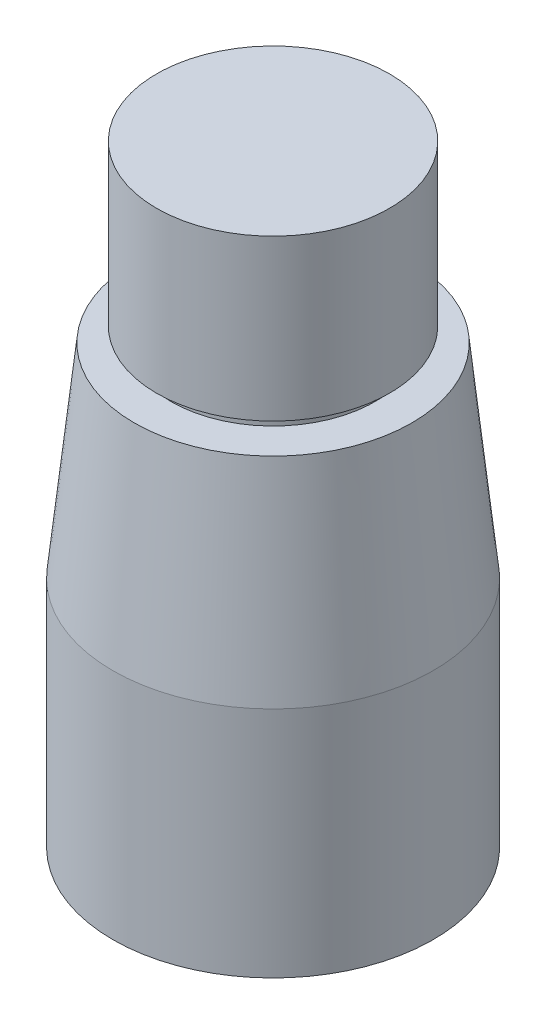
SolidWorks part; units mm, degrees
ref_plane "Front Plane" through (0, 0, 0) normal (0, 0, 1) x (1, 0, 0)
ref_plane "Top Plane" through (0, 0, 0) normal (0, 1, 0) x (1, 0, 0)
ref_plane "Right Plane" through (0, 0, 0) normal (1, 0, 0) x (0, 0, -1)
sketch "Sketch1" plane through (0, 0, 0) normal (0, 0, 1) x (1, 0, 0)
  line L0 (0, 85.1026) -> (0, 0) construction
  line L1 (0, 0) -> (-11, 0)
  line L2 (-11, 0) -> (-11, 16)
  line L3 (-11, 16) -> (-9.5285, 30)
  line L4 (-9.5285, 30) -> (-7, 30)
  line L5 (-7, 30) -> (-7, 31)
  line L6 (-7, 31) -> (-8, 31)
  line L7 (-8, 31) -> (-8, 42)
  line L8 (-8, 42) -> (0, 42)
  line L9 (0, 0) -> (0, 42)
  dimension "D1" = 42
  dimension "D2" = 1
  dimension "D3" = 14
  dimension "D4" = 6
  dimension "D5" = 11
  dimension "D6" = 11
  dimension "D7" = 8
  dimension "D8" = 1
revolve "Revolve1" add sketch "Sketch1" angle 360 about L0
